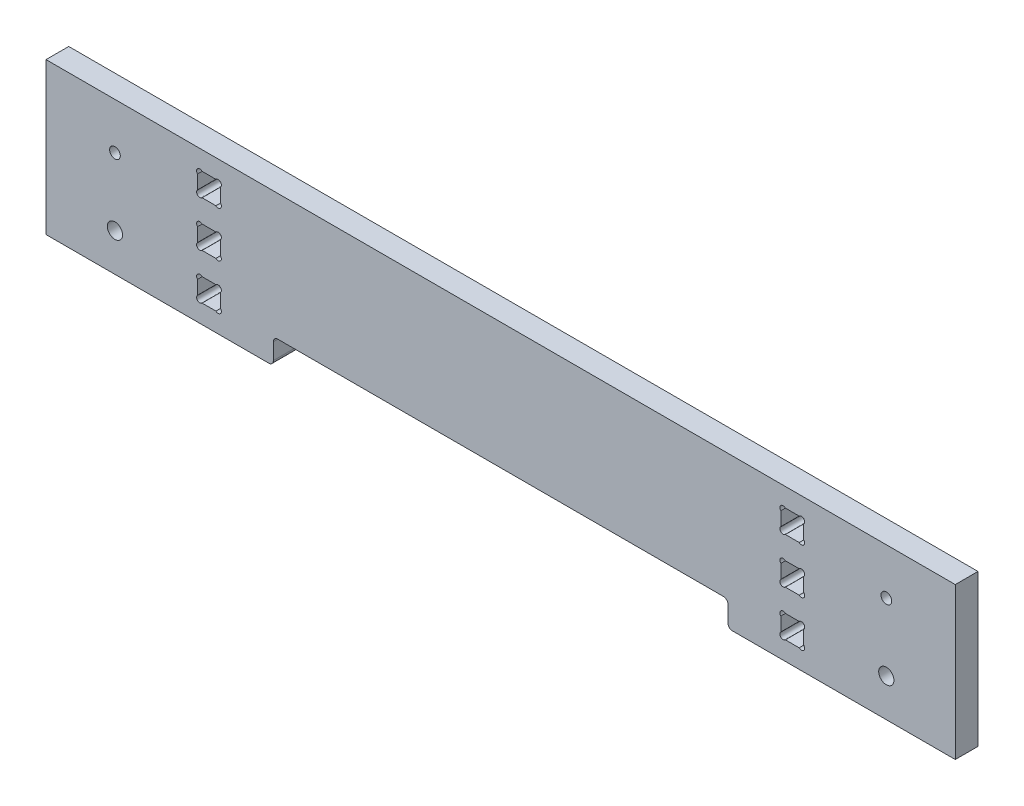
SolidWorks part; units mm, degrees
ref_plane "Ebene vorne" through (0, 0, 0) normal (0, 0, 1) x (1, 0, 0)
ref_plane "Ebene oben" through (0, 0, 0) normal (0, 1, 0) x (1, 0, 0)
ref_plane "Ebene rechts" through (0, 0, 0) normal (1, 0, 0) x (0, 0, -1)
sketch "Skizze1" plane through (0, 0, 0) normal (0, 0, 1) x (1, 0, 0)
  line L0 (0, 0) -> (150, 0)
  line L1 (150, 0) -> (150, 16.7043)
  line L2 (0, 0) -> (0, 100)
  line L3 (0, 100) -> (600, 100)
  line L4 (600, 0) -> (600, 100)
  line L5 (150, 16.7043) -> (450, 16.7043)
  line L6 (450, 16.7043) -> (450, 0)
  line L7 (450, 0) -> (600, 0)
  dimension "D1" = 600
  dimension "D2" = 100
  dimension "D3" = 150
  dimension "D4" = 150
extrude "Aufsatz-Linear austragen1" add sketch "Skizze1" along normal blind 15
sketch "Skizze2" plane through (0, 0, 15) normal (0, 0, 1) x (1, 0, 0)
  line L0 (115.1, 45.45) -> (115.1, 54.55)
  line L1 (103, 42.45) -> (112.1, 42.45)
  line L2 (112.1, 57.55) -> (103, 57.55)
  line L3 (100, 54.55) -> (100, 45.45)
  line L4 (115.1, 75.55) -> (115.1, 84.65)
  line L5 (103, 72.55) -> (112.1, 72.55)
  line L6 (112.1, 87.65) -> (103, 87.65)
  line L7 (100, 84.65) -> (100, 75.55)
  line L8 (0, 100) -> (0, 0) construction
  line L9 (115.1, 15.35) -> (115.1, 24.45)
  line L10 (103, 12.35) -> (112.1, 12.35)
  line L11 (112.1, 27.45) -> (103, 27.45)
  line L12 (100, 24.45) -> (100, 15.35)
  line L13 (500, 84.65) -> (500, 75.55)
  line L14 (500, 45.45) -> (500, 54.55)
  line L15 (487.9, 42.45) -> (497, 42.45)
  line L16 (497, 57.55) -> (487.9, 57.55)
  line L17 (484.9, 54.55) -> (484.9, 45.45)
  line L18 (0, 0) -> (150, 0) construction
  line L19 (487.9, 72.55) -> (497, 72.55)
  line L20 (497, 87.65) -> (487.9, 87.65)
  line L21 (484.9, 84.65) -> (484.9, 75.55)
  line L22 (500, 15.35) -> (500, 24.45)
  line L23 (487.9, 12.35) -> (497, 12.35)
  line L24 (497, 27.45) -> (487.9, 27.45)
  line L25 (484.9, 24.45) -> (484.9, 15.35)
  line L27 (600, 100) -> (0, 100) construction
  line L29 (450, 0) -> (600, 0) construction
  arc A0 (100, 54.55) -> (103, 57.55) centre (101.5, 56.05) cw
  arc A1 (100, 45.45) -> (103, 42.45) centre (101.5, 43.95) ccw
  arc A2 (112.1, 42.45) -> (115.1, 45.45) centre (113.6, 43.95) ccw
  arc A3 (115.1, 54.55) -> (112.1, 57.55) centre (113.6, 56.05) ccw
  arc A4 (100, 84.65) -> (103, 87.65) centre (101.5, 86.15) cw
  arc A5 (100, 75.55) -> (103, 72.55) centre (101.5, 74.05) ccw
  arc A6 (112.1, 72.55) -> (115.1, 75.55) centre (113.6, 74.05) ccw
  arc A7 (115.1, 84.65) -> (112.1, 87.65) centre (113.6, 86.15) ccw
  arc A8 (100, 24.45) -> (103, 27.45) centre (101.5, 25.95) cw
  arc A9 (100, 15.35) -> (103, 12.35) centre (101.5, 13.85) ccw
  arc A10 (112.1, 12.35) -> (115.1, 15.35) centre (113.6, 13.85) ccw
  arc A11 (115.1, 24.45) -> (112.1, 27.45) centre (113.6, 25.95) ccw
  arc A12 (484.9, 54.55) -> (487.9, 57.55) centre (486.4, 56.05) cw
  arc A13 (484.9, 45.45) -> (487.9, 42.45) centre (486.4, 43.95) ccw
  arc A14 (497, 42.45) -> (500, 45.45) centre (498.5, 43.95) ccw
  arc A15 (500, 54.55) -> (497, 57.55) centre (498.5, 56.05) ccw
  arc A16 (484.9, 84.65) -> (487.9, 87.65) centre (486.4, 86.15) cw
  arc A17 (484.9, 75.55) -> (487.9, 72.55) centre (486.4, 74.05) ccw
  arc A18 (497, 72.55) -> (500, 75.55) centre (498.5, 74.05) ccw
  arc A19 (500, 84.65) -> (497, 87.65) centre (498.5, 86.15) ccw
  arc A20 (484.9, 24.45) -> (487.9, 27.45) centre (486.4, 25.95) cw
  arc A21 (484.9, 15.35) -> (487.9, 12.35) centre (486.4, 13.85) ccw
  arc A22 (497, 12.35) -> (500, 15.35) centre (498.5, 13.85) ccw
  arc A23 (500, 24.45) -> (497, 27.45) centre (498.5, 25.95) ccw
  circle A28 centre (554.5, 69.5) radius 3.525
  circle A29 centre (554.5, 25) radius 5.025
  circle A31 centre (45.5, 69.5) radius 3.525
  circle A32 centre (45.5, 25) radius 5.025
  dimension "D12" = 3
  dimension "D13" = 9.1
  dimension "D14" = 9.1
  dimension "D15" = 3
  dimension "D10" = 3
  dimension "D11" = 3
  dimension "D17" = 3
  dimension "D21" = 3
  dimension "D22" = 3
  dimension "D23" = 9.1
  dimension "D24" = 3
  dimension "D29" = 7.05
  dimension "D32" = 10.05
  dimension "D33" = 25
  dimension "D34" = 3
  dimension "D35" = 3
  dimension "D38" = 7.05
  dimension "D39" = 10.05
  dimension "D5" = 3
  dimension "D6" = 9.1
  dimension "D8" = 9.1
  dimension "D9" = 3
  dimension "D16" = 3
  dimension "D18" = 9.1
  dimension "D19" = 9.1
  dimension "D20" = 3
  dimension "D25" = 9.1
  dimension "D26" = 3
  dimension "D27" = 3
  dimension "D28" = 9.1
  dimension "D30" = 9.1
  dimension "D31" = 3
  dimension "D36" = 3
  dimension "D37" = 3
  dimension "D40" = 9.1
  dimension "D41" = 9.1
  dimension "D42" = 25
  dimension "D43" = 3
  dimension "D44" = 3
  dimension "D45" = 3
  dimension "D46" = 15
  dimension "D47" = 15
  dimension "D48" = 100
  dimension "D49" = 3
  dimension "D50" = 3
  dimension "D51" = 3
  dimension "D52" = 9.1
  dimension "D53" = 3
  dimension "D54" = 3
  dimension "D55" = 9.1
  dimension "D56" = 9.1
  dimension "D57" = 3
  dimension "D58" = 3
  dimension "D59" = 3
  dimension "D60" = 12.35
  dimension "D61" = 9.1
  dimension "D62" = 3
  dimension "D63" = 3
  dimension "D64" = 9.1
  dimension "D65" = 9.1
  dimension "D66" = 3
  dimension "D69" = 12.35
  dimension "D70" = 15
  dimension "D71" = 15
  dimension "D73" = 3
extrude "Schnitt-Linear austragen1" cut sketch "Skizze2" against normal blind 15 contours L13 A19 L20 A16 L21 A17 L19 A18 | L22 A23 L24 A20 L25 A21 L23 A22 | L14 A15 L16 A12 L17 A13 L15 A14
sketch "Skizze4" plane through (0, 0, 15) normal (0, 0, 1) x (1, 0, 0)
  circle A0 centre (554.5, 25) radius 5.025
  circle A1 centre (45.5, 25) radius 5.025
extrude "Schnitt-Linear austragen2" cut sketch "Skizze4" against normal blind 7.5
fillet "Verrundung1" radius 3 4 edges at (450, 16.7043, 7.5) (450, 0, 7.5) (150, 16.7043, 7.5) (150, 0, 7.5)
